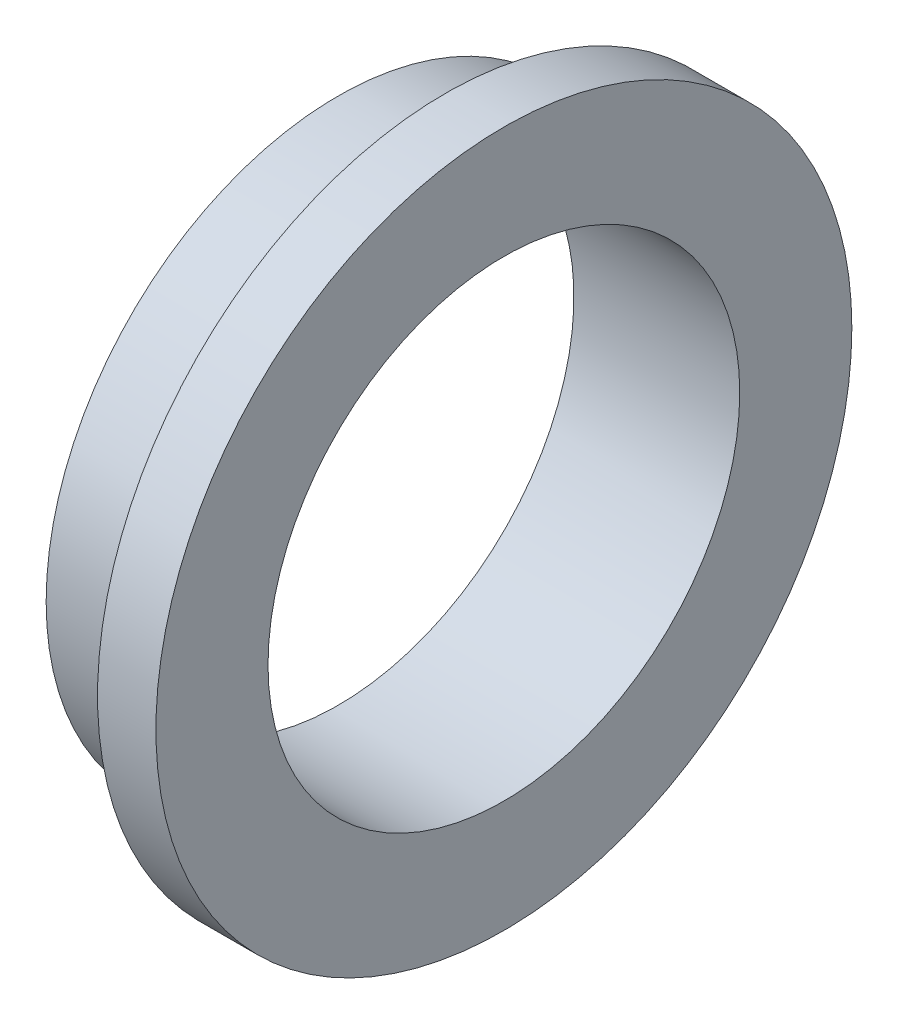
SolidWorks part; units mm, degrees
ref_plane "Front Plane" through (0, 0, 0) normal (0, 0, 1) x (1, 0, 0)
ref_plane "Top Plane" through (0, 0, 0) normal (0, 1, 0) x (1, 0, 0)
ref_plane "Right Plane" through (0, 0, 0) normal (1, 0, 0) x (0, 0, -1)
sketch "Sketch1" plane through (0, 0, 0) normal (1, 0, 0) x (0, 0, -1)
  circle A0 centre (0, 0) radius 12.827
  circle A1 centre (0, 0) radius 18.923
  dimension "D1" = 25.654
  dimension "D2" = 37.846
extrude "Boss-Extrude1" add sketch "Sketch1" along normal blind 3.175
sketch "Sketch2" plane through (0, 0, 0) normal (-1, 0, 0) x (0, 0, 1)
  circle A0 centre (0, 0) radius 12.827 construction
  circle A1 centre (0, 0) radius 12.827
  circle A2 centre (0, 0) radius 15.875
  dimension "D1" = 31.75
extrude "Boss-Extrude2" add sketch "Sketch2" along normal blind 5.842
